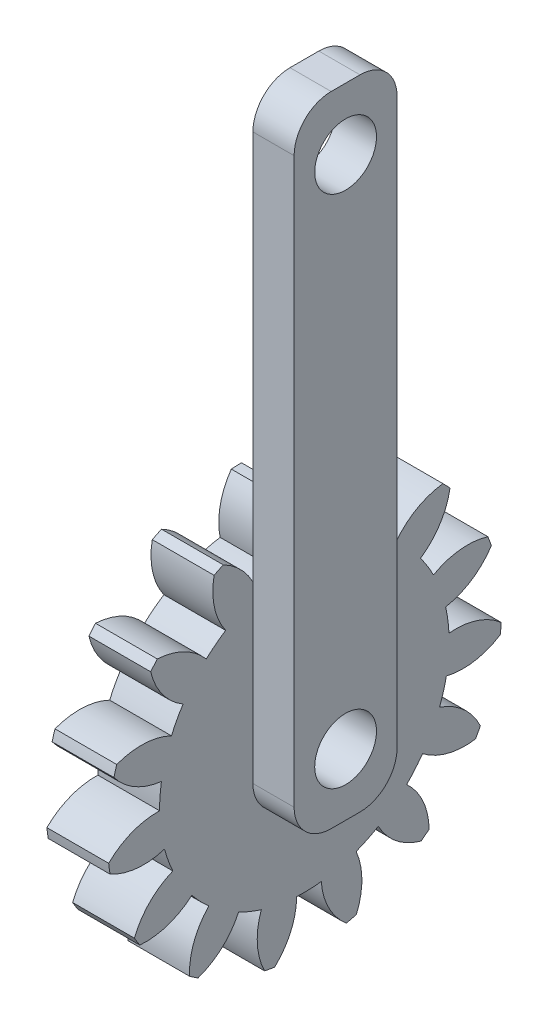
SolidWorks part; units mm, degrees
ref_plane "Front Plane" through (0, 0, 0) normal (0, 0, 1) x (1, 0, 0)
ref_plane "Top Plane" through (0, 0, 0) normal (0, 1, 0) x (1, 0, 0)
ref_plane "Right Plane" through (0, 0, 0) normal (1, 0, 0) x (0, 0, -1)
sketch "Sketch1" plane through (0, 0, 0) normal (1, 0, 0) x (0, 0, -1)
  line L0 (-2.5, 0) -> (2.5, 0)
  line L1 (2.5, 0) -> (2.5, 31)
  line L2 (2.5, 31) -> (-2.5, 31)
  line L3 (-2.5, 31) -> (-2.5, 0)
  line L4 (0, 31) -> (0, 0) construction
  circle A0 centre (0, 28) radius 1.5
  circle A1 centre (0, 3) radius 1.5
  dimension "D3" = 3
  dimension "D4" = 3
  dimension "D5" = 3
  dimension "D6" = 3
  dimension "4" = 5
  dimension "D2" = 31
extrude "Boss-Extrude1" add sketch "Sketch1" along normal blind 2
fillet "Fillet1" radius 1.8 4 edges at (1, 0, 2.5) (1, 0, -2.5) (1, 31, 2.5) (1, 31, -2.5)
sketch "Sketch5" plane through (0, 0, 0) normal (-1, 0, 0) x (0, 0, 1)
  circle A0 centre (0, 3) radius 1.5 construction
  circle A1 centre (0, 3) radius 1.5
  arc A60 (-6.2672, 6.1854) -> (-8.9092, 6.4738) centre (-7.9249, 3.2455) ccw
  arc A61 (-5.6378, 7.1999) -> (-6.2672, 6.1854) centre (0, 3) ccw
  arc A62 (-7.0699, 9.4388) -> (-5.6378, 7.1999) centre (-3.7403, 9.991) ccw
  arc A63 (-6.7261, 9.7972) -> (-7.0699, 9.4388) centre (0, 3) ccw
  arc A64 (-4.4298, 8.4591) -> (-6.7261, 9.7972) centre (-7.1399, 6.4476) ccw
  arc A65 (-3.4422, 9.1299) -> (-4.4298, 8.4591) centre (0, 3) ccw
  arc A66 (-3.8397, 11.7577) -> (-3.4422, 9.1299) centre (-0.5735, 10.9079) ccw
  arc A67 (-3.3799, 11.9453) -> (-3.8397, 11.7577) centre (0, 3) ccw
  arc A68 (-1.8264, 9.7889) -> (-3.3799, 11.9453) centre (-5.1203, 9.0536) ccw
  arc A69 (-0.6513, 10) -> (-1.8264, 9.7889) centre (0, 3) ccw
  arc A70 (0.0543, 12.5623) -> (-0.6513, 10) centre (2.6925, 10.4575) ccw
  arc A71 (0.5507, 12.5466) -> (0.0543, 12.5623) centre (0, 3) ccw
  arc A72 (1.0928, 9.9448) -> (0.5507, 12.5466) centre (-2.2154, 10.6129) ccw
  arc A73 (2.2522, 9.6597) -> (1.0928, 9.9448) centre (0, 3) ccw
  arc A74 (3.939, 11.7135) -> (2.2522, 9.6597) centre (5.493, 8.7176) ccw
  arc A75 (4.386, 11.4973) -> (3.939, 11.7135) centre (0, 3) ccw
  arc A76 (3.823, 8.8999) -> (4.386, 11.4973) centre (1.0726, 10.8558) ccw
  arc A77 (4.7662, 8.1679) -> (3.823, 8.8999) centre (0, 3) ccw
  arc A78 (7.1426, 9.3581) -> (4.7662, 8.1679) centre (7.3436, 5.9891) ccw
  arc A79 (7.463, 8.9787) -> (7.1426, 9.3581) centre (0, 3) ccw
  arc A80 (5.8922, 6.8349) -> (7.463, 8.9787) centre (4.1751, 9.7404) ccw
  arc A81 (6.4561, 5.7826) -> (5.8922, 6.8349) centre (0, 3) ccw
  arc A82 (9.1111, 5.9033) -> (6.4561, 5.7826) centre (7.9245, 2.7437) ccw
  arc A83 (9.2496, 5.4264) -> (9.1111, 5.9033) centre (0, 3) ccw
  arc A84 (6.9426, 4.1067) -> (9.2496, 5.4264) centre (6.5557, 7.4595) ccw
  arc A85 (7.0297, 2.9161) -> (6.9426, 4.1067) centre (0, 3) ccw
  arc A86 (9.5043, 1.9464) -> (7.0297, 2.9161) centre (7.1352, -0.4573) ccw
  arc A87 (9.4368, 1.4545) -> (9.5043, 1.9464) centre (0, 3) ccw
  arc A88 (6.7925, 1.1872) -> (9.4368, 1.4545) centre (7.8027, 4.4075) ccw
  arc A89 (6.3878, 0.0641) -> (6.7925, 1.1872) centre (0, 3) ccw
  arc A90 (8.2541, -1.8282) -> (6.3878, 0.0641) centre (5.1121, -3.0605) ccw
  arc A91 (7.9923, -2.2502) -> (8.2541, -1.8282) centre (0, 3) ccw
  arc A92 (5.468, -1.4188) -> (7.9923, -2.2502) centre (7.7006, 1.1122) ccw
  arc A93 (4.6414, -2.2803) -> (5.468, -1.4188) centre (0, 3) ccw
  arc A94 (5.5767, -4.768) -> (4.6414, -2.2803) centre (2.2051, -4.6159) ccw
  arc A95 (5.1659, -5.0471) -> (5.5767, -4.768) centre (0, 3) ccw
  arc A96 (3.1979, -3.2608) -> (5.1659, -5.0471) centre (6.267, -1.8567) ccw
  arc A97 (2.0925, -3.7116) -> (3.1979, -3.2608) centre (0, 3) ccw
  arc A98 (1.935, -6.3647) -> (2.0925, -3.7116) centre (-1.0832, -4.8543) ccw
  arc A99 (1.4462, -6.4525) -> (1.935, -6.3647) centre (0, 3) ccw
  arc A100 (0.375, -4.0202) -> (1.4462, -6.4525) centre (3.7498, -3.9859) ccw
  arc A101 (-0.8183, -3.9825) -> (0.375, -4.0202) centre (0, 3) ccw
  arc A102 (-2.0413, -6.3421) -> (-0.8183, -3.9825) centre (-4.1842, -3.7347) ccw
  arc A103 (-2.5235, -6.2235) -> (-2.0413, -6.3421) centre (0, 3) ccw
  arc A104 (-2.5128, -3.5658) -> (-2.5235, -6.2235) centre (0.5842, -4.9071) ccw
  arc A105 (-3.5876, -3.046) -> (-2.5128, -3.5658) centre (0, 3) ccw
  arc A106 (-5.6646, -4.7042) -> (-3.5876, -3.046) centre (-6.5617, -1.4506) ccw
  arc A107 (-6.0569, -4.3997) -> (-5.6646, -4.7042) centre (0, 3) ccw
  arc A108 (-4.9662, -1.9761) -> (-6.0569, -4.3997) centre (-2.6824, -4.4611) ccw
  arc A109 (-5.7365, -1.0641) -> (-4.9662, -1.9761) centre (0, 3) ccw
  arc A110 (-8.3084, -1.7341) -> (-5.7365, -1.0641) centre (-7.8046, 1.6031) ccw
  arc A111 (-8.543, -1.2964) -> (-8.3084, -1.7341) centre (0, 3) ccw
  arc A112 (-6.5608, 0.474) -> (-8.543, -1.2964) centre (-5.4852, -2.725) ccw
  arc A113 (-6.8936, 1.6205) -> (-6.5608, 0.474) centre (0, 3) ccw
  arc A114 (-9.5156, 2.0545) -> (-6.8936, 1.6205) centre (-7.6981, 4.8983) ccw
  arc A115 (-9.5519, 2.5498) -> (-9.5156, 2.0545) centre (0, 3) ccw
  arc A116 (-7.021, 3.3609) -> (-9.5519, 2.5498) centre (-7.3396, 0.001) ccw
  arc A117 (-6.8587, 4.5437) -> (-7.021, 3.3609) centre (0, 3) ccw
  arc A118 (-9.0775, 6.0066) -> (-6.8587, 4.5437) centre (-6.2604, 7.8652) ccw
  arc A119 (-8.9092, 6.4738) -> (-9.0775, 6.0066) centre (0, 3) ccw
  arc A120 (-6.2672, 6.1854) -> (-8.9092, 6.4738) centre (-7.9249, 3.2455) ccw
  arc A121 (-5.6378, 7.1999) -> (-6.2672, 6.1854) centre (0, 3) ccw
  arc A122 (-7.0699, 9.4388) -> (-5.6378, 7.1999) centre (-3.7403, 9.991) ccw
  arc A123 (-6.7261, 9.7972) -> (-7.0699, 9.4388) centre (0, 3) ccw
  arc A124 (-4.4298, 8.4591) -> (-6.7261, 9.7972) centre (-7.1399, 6.4476) ccw
  arc A125 (-3.4422, 9.1299) -> (-4.4298, 8.4591) centre (0, 3) ccw
  arc A126 (-3.8397, 11.7577) -> (-3.4422, 9.1299) centre (-0.5735, 10.9079) ccw
  arc A127 (-3.3799, 11.9453) -> (-3.8397, 11.7577) centre (0, 3) ccw
  arc A128 (-1.8264, 9.7889) -> (-3.3799, 11.9453) centre (-5.1203, 9.0536) ccw
  arc A129 (-0.6513, 10) -> (-1.8264, 9.7889) centre (0, 3) ccw
  arc A130 (0.0543, 12.5623) -> (-0.6513, 10) centre (2.6925, 10.4575) ccw
  arc A131 (0.5507, 12.5466) -> (0.0543, 12.5623) centre (0, 3) ccw
  arc A132 (1.0928, 9.9448) -> (0.5507, 12.5466) centre (-2.2154, 10.6129) ccw
  arc A133 (2.2522, 9.6597) -> (1.0928, 9.9448) centre (0, 3) ccw
  arc A134 (3.939, 11.7135) -> (2.2522, 9.6597) centre (5.493, 8.7176) ccw
  arc A135 (4.386, 11.4973) -> (3.939, 11.7135) centre (0, 3) ccw
  arc A136 (3.823, 8.8999) -> (4.386, 11.4973) centre (1.0726, 10.8558) ccw
  arc A137 (4.7662, 8.1679) -> (3.823, 8.8999) centre (0, 3) ccw
  arc A138 (7.1426, 9.3581) -> (4.7662, 8.1679) centre (7.3436, 5.9891) ccw
  arc A139 (7.463, 8.9787) -> (7.1426, 9.3581) centre (0, 3) ccw
  arc A140 (5.8922, 6.8349) -> (7.463, 8.9787) centre (4.1751, 9.7404) ccw
  arc A141 (6.4561, 5.7826) -> (5.8922, 6.8349) centre (0, 3) ccw
  arc A142 (9.1111, 5.9033) -> (6.4561, 5.7826) centre (7.9245, 2.7437) ccw
  arc A143 (9.2496, 5.4264) -> (9.1111, 5.9033) centre (0, 3) ccw
  arc A144 (6.9426, 4.1067) -> (9.2496, 5.4264) centre (6.5557, 7.4595) ccw
  arc A145 (7.0297, 2.9161) -> (6.9426, 4.1067) centre (0, 3) ccw
  arc A146 (9.5043, 1.9464) -> (7.0297, 2.9161) centre (7.1352, -0.4573) ccw
  arc A147 (9.4368, 1.4545) -> (9.5043, 1.9464) centre (0, 3) ccw
  arc A148 (6.7925, 1.1872) -> (9.4368, 1.4545) centre (7.8027, 4.4075) ccw
  arc A149 (6.3878, 0.0641) -> (6.7925, 1.1872) centre (0, 3) ccw
  arc A150 (8.2541, -1.8282) -> (6.3878, 0.0641) centre (5.1121, -3.0605) ccw
  arc A151 (7.9923, -2.2502) -> (8.2541, -1.8282) centre (0, 3) ccw
  arc A152 (5.468, -1.4188) -> (7.9923, -2.2502) centre (7.7006, 1.1122) ccw
  arc A153 (4.6414, -2.2803) -> (5.468, -1.4188) centre (0, 3) ccw
  arc A154 (5.5767, -4.768) -> (4.6414, -2.2803) centre (2.2051, -4.6159) ccw
  arc A155 (5.1659, -5.0471) -> (5.5767, -4.768) centre (0, 3) ccw
  arc A156 (3.1979, -3.2608) -> (5.1659, -5.0471) centre (6.267, -1.8567) ccw
  arc A157 (2.0925, -3.7116) -> (3.1979, -3.2608) centre (0, 3) ccw
  arc A158 (1.935, -6.3647) -> (2.0925, -3.7116) centre (-1.0832, -4.8543) ccw
  arc A159 (1.4462, -6.4525) -> (1.935, -6.3647) centre (0, 3) ccw
  arc A160 (0.375, -4.0202) -> (1.4462, -6.4525) centre (3.7498, -3.9859) ccw
  arc A161 (-0.8183, -3.9825) -> (0.375, -4.0202) centre (0, 3) ccw
  arc A162 (-2.0413, -6.3421) -> (-0.8183, -3.9825) centre (-4.1842, -3.7347) ccw
  arc A163 (-2.5235, -6.2235) -> (-2.0413, -6.3421) centre (0, 3) ccw
  arc A164 (-2.5128, -3.5658) -> (-2.5235, -6.2235) centre (0.5842, -4.9071) ccw
  arc A165 (-3.5876, -3.046) -> (-2.5128, -3.5658) centre (0, 3) ccw
  arc A166 (-5.6646, -4.7042) -> (-3.5876, -3.046) centre (-6.5617, -1.4506) ccw
  arc A167 (-6.0569, -4.3997) -> (-5.6646, -4.7042) centre (0, 3) ccw
  arc A168 (-4.9662, -1.9761) -> (-6.0569, -4.3997) centre (-2.6824, -4.4611) ccw
  arc A169 (-5.7365, -1.0641) -> (-4.9662, -1.9761) centre (0, 3) ccw
  arc A170 (-8.3084, -1.7341) -> (-5.7365, -1.0641) centre (-7.8046, 1.6031) ccw
  arc A171 (-8.543, -1.2964) -> (-8.3084, -1.7341) centre (0, 3) ccw
  arc A172 (-6.5608, 0.474) -> (-8.543, -1.2964) centre (-5.4852, -2.725) ccw
  arc A173 (-6.8936, 1.6205) -> (-6.5608, 0.474) centre (0, 3) ccw
  arc A174 (-9.5156, 2.0545) -> (-6.8936, 1.6205) centre (-7.6981, 4.8983) ccw
  arc A175 (-9.5519, 2.5498) -> (-9.5156, 2.0545) centre (0, 3) ccw
  arc A176 (-7.021, 3.3609) -> (-9.5519, 2.5498) centre (-7.3396, 0.001) ccw
  arc A177 (-6.8587, 4.5437) -> (-7.021, 3.3609) centre (0, 3) ccw
  arc A178 (-9.0775, 6.0066) -> (-6.8587, 4.5437) centre (-6.2604, 7.8652) ccw
  arc A179 (-8.9092, 6.4738) -> (-9.0775, 6.0066) centre (0, 3) ccw
  dimension "D1" = 0
extrude "Boss-Extrude2" add sketch "Sketch5" along normal blind 3
